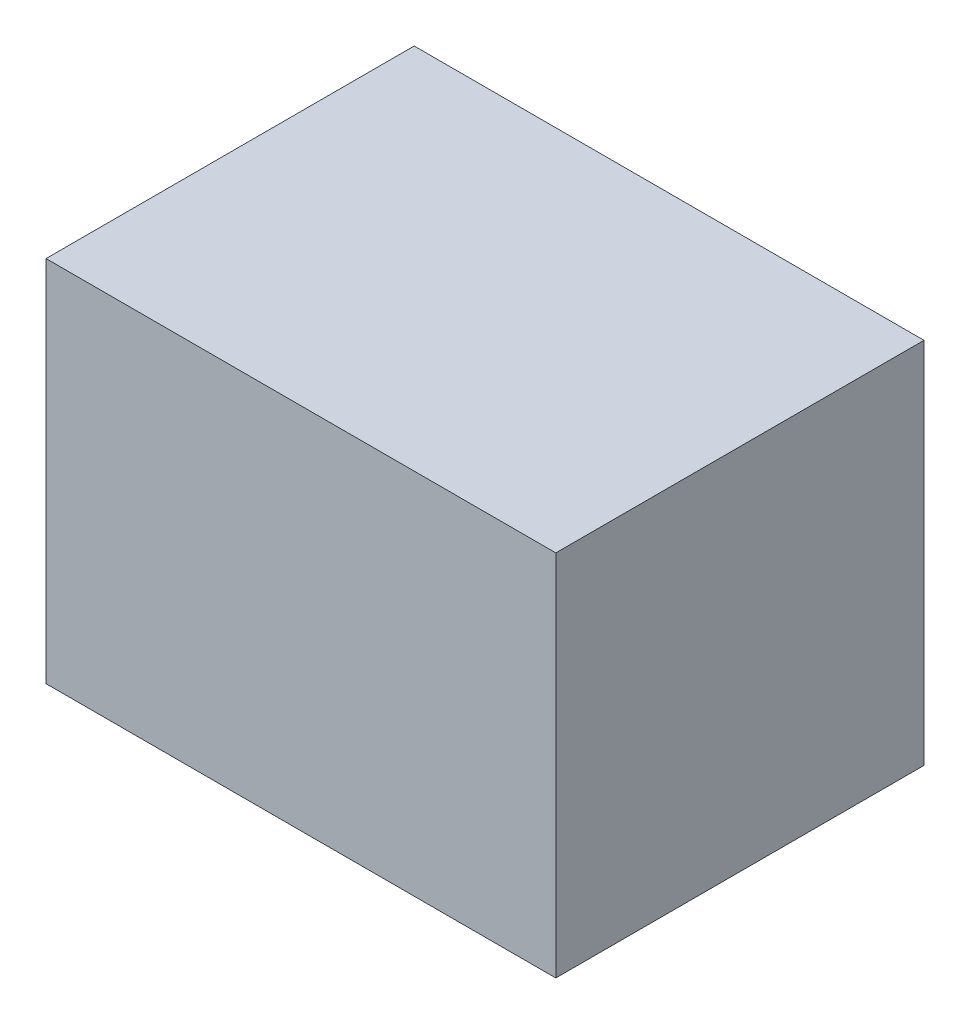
SolidWorks part; units mm, degrees
ref_plane "Front Plane" through (0, 0, 0) normal (0, 0, 1) x (1, 0, 0)
ref_plane "Top Plane" through (0, 0, 0) normal (0, 1, 0) x (1, 0, 0)
ref_plane "Right Plane" through (0, 0, 0) normal (1, 0, 0) x (0, 0, -1)
sketch "Sketch1" plane through (0, 0, 0) normal (0, 1, 0) x (1, 0, 0)
  line L1 (-2.286, -1.651) -> (2.286, -1.651)
  line L2 (-2.286, -1.651) -> (-2.286, 1.651)
  line L3 (-2.286, 1.651) -> (2.286, 1.651)
  line L4 (2.286, -1.651) -> (2.286, 1.651)
  line L5 (-2.286, -1.651) -> (2.286, 1.651) construction
  line L6 (-2.286, 1.651) -> (2.286, -1.651) construction
  point P0 (0, 0)
extrude "Boss-Extrude1" add sketch "Sketch1" along normal blind 3.302
